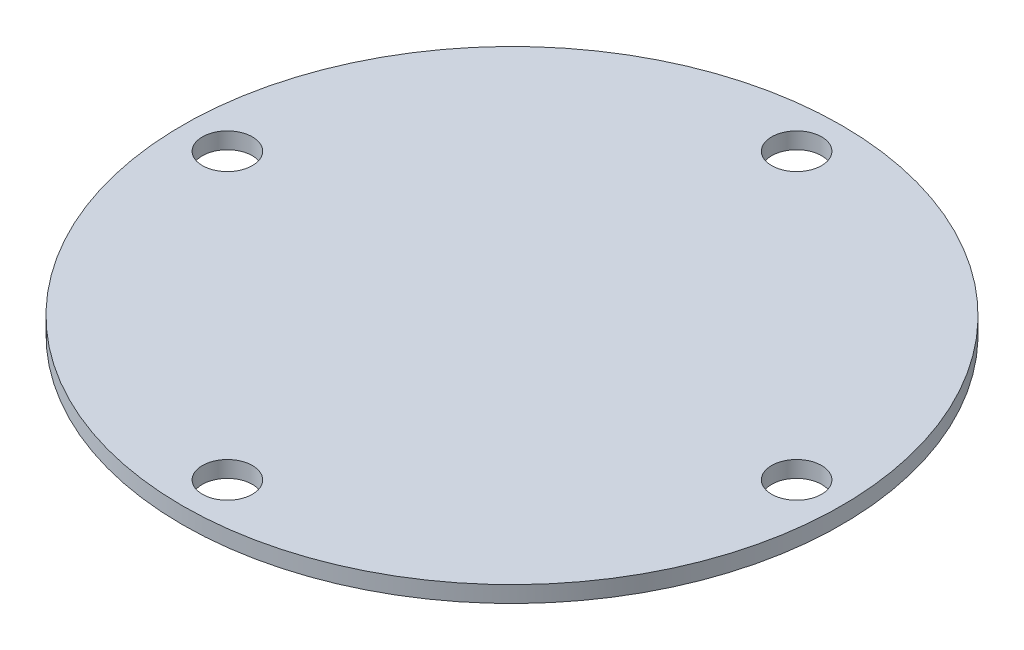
SolidWorks part; units mm, degrees
ref_plane "Front Plane" through (0, 0, 0) normal (0, 0, 1) x (1, 0, 0)
ref_plane "Top Plane" through (0, 0, 0) normal (0, 1, 0) x (1, 0, 0)
ref_plane "Right Plane" through (0, 0, 0) normal (1, 0, 0) x (0, 0, -1)
sketch "Sketch1" plane through (0, 0, 0) normal (0, 1, 0) x (1, 0, 0)
  circle A0 centre (0, 0) radius 33
  circle A1 centre (0, 0) radius 28.5 construction
  circle A2 centre (0, 28.5) radius 2.5
  circle A3 centre (28.5, 0) radius 2.5
  circle A4 centre (0, -28.5) radius 2.5
  circle A5 centre (-28.5, 0) radius 2.5
  dimension "D1" = 4
extrude "Boss-Extrude1" add sketch "Sketch1" along normal blind 1.64
